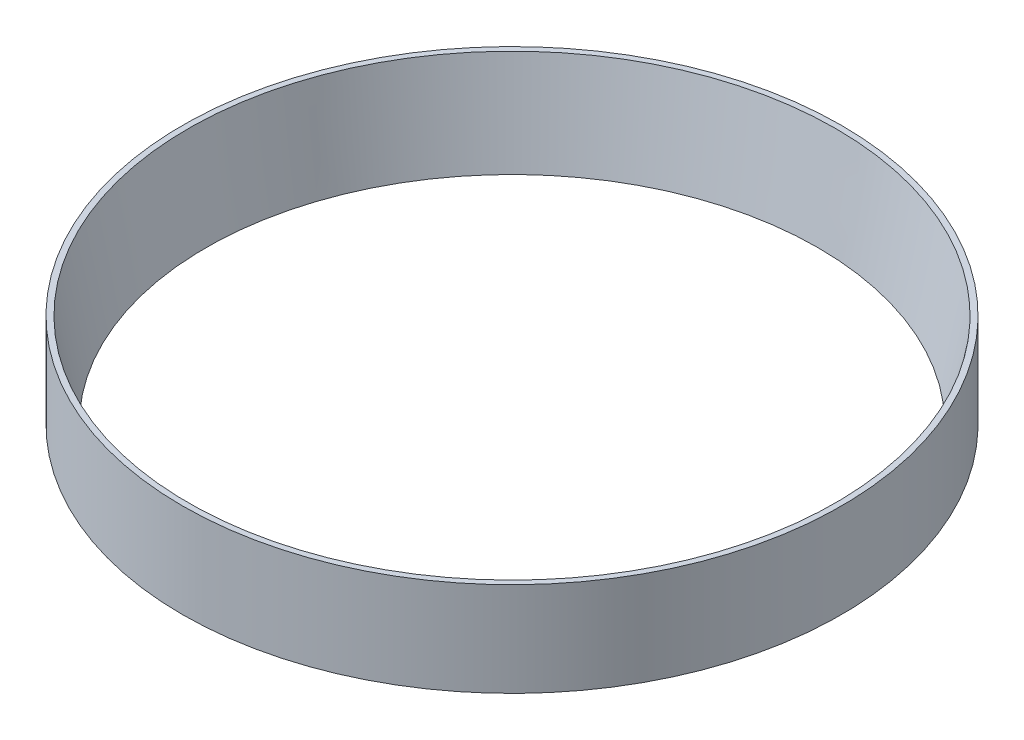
SolidWorks part; units mm, degrees
ref_plane "Front Plane" through (0, 0, 0) normal (0, 0, 1) x (1, 0, 0)
ref_plane "Top Plane" through (0, 0, 0) normal (0, 1, 0) x (1, 0, 0)
ref_plane "Right Plane" through (0, 0, 0) normal (1, 0, 0) x (0, 0, -1)
sketch "Sketch1" plane through (0, 0, 0) normal (0, 1, 0) x (1, 0, 0)
  circle A0 centre (0, 0) radius 44.45
  circle A1 centre (0, 0) radius 41.275
  dimension "D1" = 88.9
  dimension "D2" = 3.175
extrude "Boss-Extrude1" add sketch "Sketch1" along normal blind 12.7
sketch "Sketch2" plane through (0, 0, 0) normal (0, 0, 1) x (1, 0, 0)
  line L0 (-43.688, 12.7) -> (-44.45, 12.7) construction
  line L1 (44.45, 12.7) -> (-44.45, 12.7) construction
  line L2 (-43.688, 12.7) -> (-41.275, 0)
  line L4 (41.275, 12.7) -> (-41.275, 12.7) construction
  line L5 (-41.275, 12.7) -> (-43.688, 12.7)
  line L6 (0, 0) -> (0, 12.7) construction
  line L7 (-41.275, 0) -> (41.275, 0) construction
  line L8 (-41.275, 0) -> (-44.45, 0) construction
  line L9 (-44.45, 0) -> (44.45, 0) construction
  line L10 (-44.45, 12.7) -> (-44.45, 0) construction
  line L11 (-41.275, 0) -> (-41.275, 12.7)
  line L14 (-41.275, 0) -> (0, 0) construction
  dimension "D1" = 44.45
  dimension "D2" = 0.762
  dimension "D3" = 41.275
  dimension "D4" = 41.275
revolve "Cut-Revolve1" cut sketch "Sketch2" angle 360 about L6
